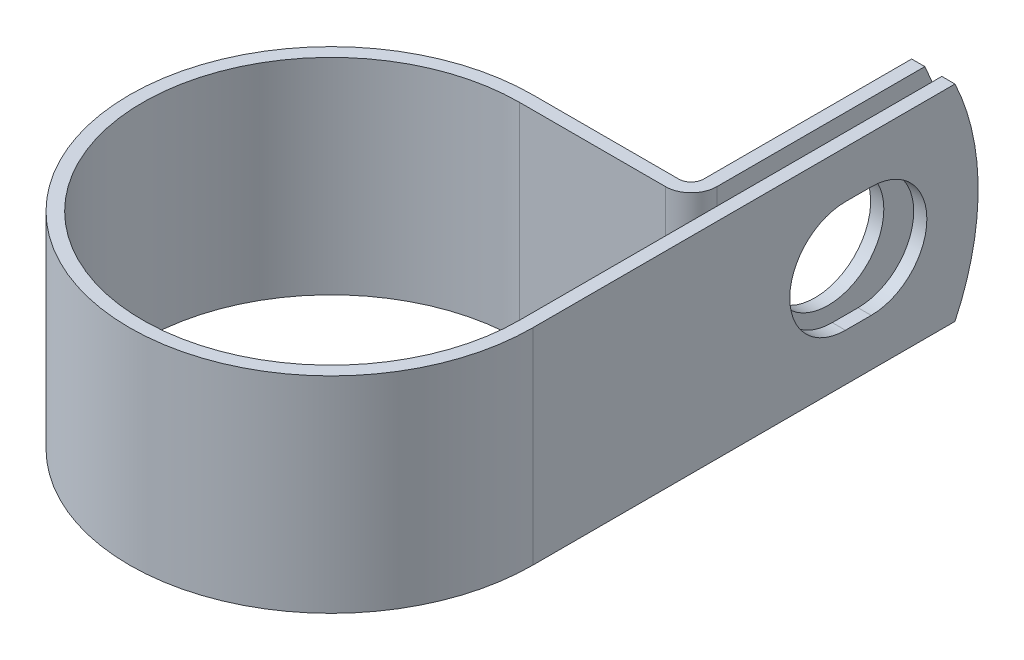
SolidWorks part; units mm, degrees
ref_plane "Front Plane" through (0, 0, 0) normal (0, 0, 1) x (1, 0, 0)
ref_plane "Top Plane" through (0, 0, 0) normal (0, 1, 0) x (1, 0, 0)
ref_plane "Right Plane" through (0, 0, 0) normal (1, 0, 0) x (0, 0, -1)
sketch "Sketch1" plane through (0, 0, 0) normal (0, 1, 0) x (1, 0, 0)
  line L0 (0, 17.4625) -> (13.5103, 17.4625)
  line L1 (17.4625, 0) -> (17.4625, 17.4625)
  line L2 (15.8877, 41.2496) -> (15.8877, 19.8399)
  line L5 (17.4625, 17.4625) -> (17.4625, 41.2496)
  arc A0 (0, 17.4625) -> (17.4625, 0) centre (0, 0) ccw
  arc A3 (13.5103, 17.4625) -> (15.8877, 19.8399) centre (13.5103, 19.8399) ccw
extrude "Extrude-Thin1" add sketch "Sketch1" along normal mid plane 19.05 thin
sketch "Sketch2" plane through (14.6685, 0, 0) normal (-1, 0, 0) x (0, 0, 1)
  line L0 (-41.2496, 9.525) -> (-41.2496, -9.525) construction
  line L7 (0, 9.525) -> (0, -9.525) construction
  circle A0 centre (-30.1498, 0) radius 5.1562
  point P2 (-41.2496, 0)
extrude "Cut-Extrude1" cut sketch "Sketch2" against normal up to surface (1.2192 mm away)
sketch "Sketch3" plane through (18.6817, 0, 0) normal (1, 0, 0) x (0, 0, -1)
  line L0 (28.956, 0) -> (31.3436, 0) construction
  line L1 (28.956, 5.1562) -> (31.3436, 5.1562)
  line L2 (28.956, -5.1562) -> (31.3436, -5.1562)
  line L3 (41.2496, 9.525) -> (41.2496, -9.525) construction
  arc A0 (28.956, 5.1562) -> (28.956, -5.1562) centre (28.956, 0) ccw
  arc A1 (31.3436, -5.1562) -> (31.3436, 5.1562) centre (31.3436, 0) ccw
  point P3 (30.1498, 0)
  point P8 (41.2496, 0)
  point P11 (23.7998, 0)
  point P12 (36.4998, 0)
extrude "Cut-Extrude2" cut sketch "Sketch3" against normal up to surface (1.2192 mm away)
sketch "Sketch4" plane through (14.6685, 0, 0) normal (-1, 0, 0) x (0, 0, 1)
  line L0 (-41.2496, 9.525) -> (-41.2496, -9.525)
  line L1 (-41.2496, 9.525) -> (-39.1051, 9.525)
  line L2 (-41.2496, 9.525) -> (-19.8399, 9.525) construction
  line L3 (-41.2496, -9.525) -> (-39.1051, -9.525)
  line L4 (-41.2496, -9.525) -> (-19.8399, -9.525) construction
  arc A0 (-39.1051, 9.525) -> (-39.1051, -9.525) centre (-19.0246, 0) ccw
extrude "Cut-Extrude3" cut sketch "Sketch4" against normal through all contours A0 M4 M5 | A0 L0 M2
equation "\"D1@Sketch3\" = \"D2@Sketch2\""
equation "\"D7@Sketch1\" = \"D3@Sketch2\" + \"D1@Sketch3\""
equation "\"D1@Sketch4\" = ( \"D1@Extrude-Thin1\" + .125 ) * 2"
equation "\"D2@Sketch1\"=1.95*\"D5@Extrude-Thin1\""
equation "\"D2@Sketch3\" = \"D1@Sketch2\""
